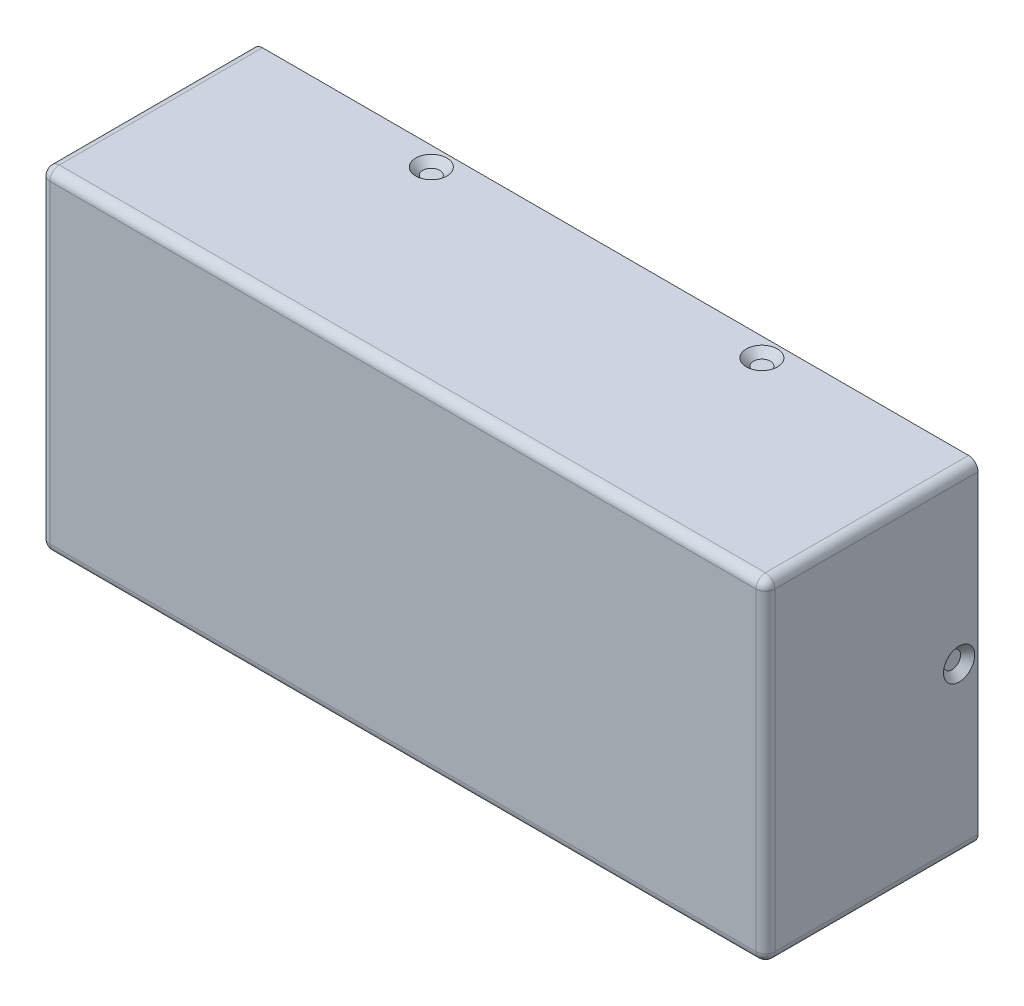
SolidWorks part; units mm, degrees
ref_plane "前视基准面" through (0, 0, 0) normal (0, 0, 1) x (1, 0, 0)
ref_plane "上视基准面" through (0, 0, 0) normal (0, 1, 0) x (1, 0, 0)
ref_plane "右视基准面" through (0, 0, 0) normal (1, 0, 0) x (0, 0, -1)
sketch "草图1" plane through (0, 0, 0) normal (0, 0, 1) x (1, 0, 0)
  line L1 (-76.75, -35.25) -> (76.75, -35.25)
  line L2 (-76.75, -35.25) -> (-76.75, 35.25)
  line L3 (-76.75, 35.25) -> (76.75, 35.25)
  line L4 (76.75, -35.25) -> (76.75, 35.25)
  line L5 (-76.75, -35.25) -> (76.75, 35.25) construction
  line L6 (-76.75, 35.25) -> (76.75, -35.25) construction
  point P0 (0, 0)
  dimension "D1" = 153.5
  dimension "D2" = 70.5
extrude "凸台-拉伸1" add sketch "草图1" along normal blind 45
fillet "圆角1" radius 2 8 edges at (0, -35.25, 45) (-76.75, 0, 45) (0, 35.25, 45) (76.75, 0, 45) (-76.75, -35.25, 22.5) (-76.75, 35.25, 22.5) (76.75, -35.25, 22.5) (76.75, 35.25, 22.5)
shell "抽壳1" thickness 1.5
sketch "草图2" plane through (0, 0, 0) normal (0, 0, -1) x (-1, 0, 0)
  line L0 (74.75, 33.75) -> (-74.75, 33.75) construction
  line L1 (75, -33.5) -> (-75, -33.5)
  line L2 (75, -33.5) -> (75, 33.5)
  line L3 (75, 33.5) -> (-75, 33.5)
  line L4 (-75, -33.5) -> (-75, 33.5)
  line L5 (75, -33.5) -> (-75, 33.5) construction
  line L6 (75, 33.5) -> (-75, -33.5) construction
  line L7 (-75.25, -33.25) -> (-75.25, 33.25) construction
  point P0 (0, 0)
  dimension "D1" = 0.25
  dimension "D2" = 0.25
extrude "凸台-拉伸2" add sketch "草图2" against normal blind 12 separate body
hole_wizard "打孔尺寸(%根据十字)槽半沉头木螺钉的类型1" positions "草图5" profile "草图4" countersink size "M3" standard "GB"
sketch "草图5" plane through (0, -35.25, 0) normal (0, -1, 0) x (-1, 0, 0)
  line L0 (0, 0) -> (0, -13.8741) construction
  line L1 (74.75, 0) -> (-74.75, 0) construction
  point P0 (-35, -4)
  point P7 (35, -4)
  dimension "D1" = 70
  dimension "D2" = 4
sketch "草图4" plane through (35, -35.25, 4) normal (1, 0, 0) x (0, 0, -1)
  line L0 (0, 0) -> (0, 70.5)
  line L1 (0, 70.5) -> (1.7, 70.5)
  line L2 (1.7, 70.5) -> (1.7, 1.6)
  line L3 (1.7, 1.6) -> (3.3, 0)
  line L5 (3.3, 0) -> (0, 0)
  line L6 (-1.7, 1.6) -> (-3.3, 0) construction
  line L11 (0, -6.35) -> (0, 107.95) construction
  dimension "通孔孔直径" = 3.4
  dimension "通孔孔深度" = 70.5
  dimension "近端锥形沉头孔直径" = 6.6
  dimension "近端锥形沉头孔角度" = 90
mirror "镜向1" about plane through (0, 0, 0) normal (0, 1, 0) of "打孔尺寸(%根据十字)槽半沉头木螺钉的类型1"
hole_wizard "打孔尺寸(%根据十字)槽半沉头木螺钉的类型2" positions "草图6" profile "草图7" countersink size "M3" standard "GB"
sketch "草图6" plane through (-76.75, 0, 0) normal (-1, 0, 0) x (0, 0, 1)
  line L0 (0, 33.25) -> (0, -33.25) construction
  point P0 (4, 0)
  dimension "D1" = 4
sketch "草图7" plane through (-76.75, 0, 4) normal (0, 1, 0) x (0, 0, 1)
  line L0 (0, 0) -> (0, 153.5)
  line L1 (0, 153.5) -> (1.7, 153.5)
  line L2 (1.7, 153.5) -> (1.7, 1.6)
  line L3 (1.7, 1.6) -> (3.3, 0)
  line L5 (3.3, 0) -> (0, 0)
  line L6 (-1.7, 1.6) -> (-3.3, 0) construction
  line L11 (0, -6.35) -> (0, 107.95) construction
  dimension "通孔孔直径" = 3.4
  dimension "通孔孔深度" = 153.5
  dimension "近端锥形沉头孔直径" = 6.6
  dimension "近端锥形沉头孔角度" = 90
mirror "镜向2" about plane through (0, 0, 0) normal (1, 0, 0) of "打孔尺寸(%根据十字)槽半沉头木螺钉的类型2"
